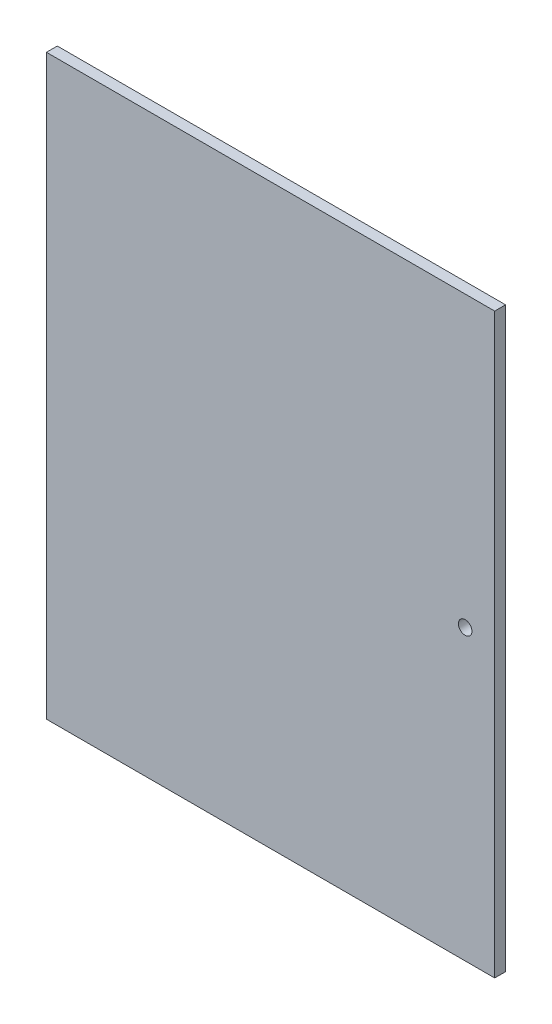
SolidWorks part; units mm, degrees
ref_plane "Front Plane" through (0, 0, 0) normal (0, 0, 1) x (1, 0, 0)
ref_plane "Top Plane" through (0, 0, 0) normal (0, 1, 0) x (1, 0, 0)
ref_plane "Right Plane" through (0, 0, 0) normal (1, 0, 0) x (0, 0, -1)
sketch "Sketch1" plane through (0, 0, 0) normal (0, 0, 1) x (1, 0, 0)
  line L0 (330.2, 0) -> (296.7, 0) construction
  line L1 (-330.2, 425.45) -> (330.2, 425.45)
  line L2 (-330.2, 425.45) -> (-330.2, -425.45)
  line L3 (-330.2, -425.45) -> (330.2, -425.45)
  line L4 (330.2, 425.45) -> (330.2, -425.45)
  line L5 (-330.2, 425.45) -> (330.2, -425.45) construction
  line L6 (-330.2, -425.45) -> (330.2, 425.45) construction
  line L7 (296.7, 0) -> (286.7, 0) construction
  circle A0 centre (286.7, 0) radius 10
  point P0 (0, 0)
  dimension "D5" = 20
  dimension "D1" = 660.4
  dimension "D2" = 850.9
  dimension "D3" = 33.5
  dimension "D4" = 10
extrude "Boss-Extrude1" add sketch "Sketch1" along normal blind 16
